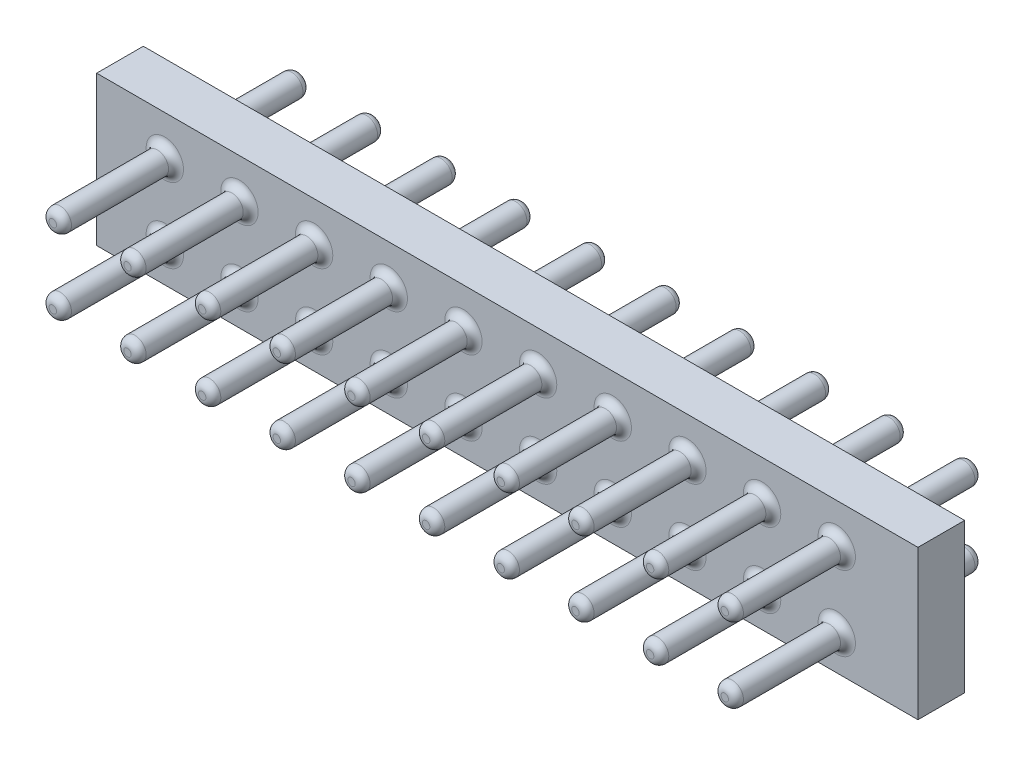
SolidWorks part; units mm, degrees
ref_plane "Front Plane" through (0, 0, 0) normal (0, 0, 1) x (1, 0, 0)
ref_plane "Top Plane" through (0, 0, 0) normal (0, 1, 0) x (1, 0, 0)
ref_plane "Right Plane" through (0, 0, 0) normal (1, 0, 0) x (0, 0, -1)
sketch "Sketch1" plane through (0, 0, 0) normal (0, 0, 1) x (1, 0, 0)
  line L1 (-60.384, -15.7687) -> (-32.444, -15.7687)
  line L2 (-60.384, -15.7687) -> (-60.384, -20.8487)
  line L3 (-60.384, -20.8487) -> (-32.444, -20.8487)
  line L4 (-32.444, -15.7687) -> (-32.444, -20.8487)
  dimension "D1" = 27.94
  dimension "D2" = 5.08
extrude "Extrude1" add sketch "Sketch1" along normal blind 1.5875
sketch "Sketch2" plane through (0, 0, 1.5875) normal (0, 0, 1) x (1, 0, 0)
  circle A0 centre (-58.0653, -17.1247) radius 0.381
  dimension "D1" = 0.762
extrude "Extrude2" add sketch "Sketch2" along normal blind 3.81 and the other way blind 4.572
fillet "Fillet1" radius 0.254 4 edges at (-57.6843, -17.1247, 1.5875) (-57.6843, -17.1247, 5.3975) (-57.6843, -17.1247, 0) (-57.6843, -17.1247, -2.9845)
pattern_linear "LPattern2" count 10 spacing 2.54 along (1, 0, 0) count 2 spacing 2.54 along (0, -1, 0) of "Extrude2"
fillet "Fillet2" radius 0.254 76 edges at (-57.6843, -19.6647, 1.5875) (-57.6843, -19.6647, 5.3975) (-55.1443, -17.1247, 1.5875) (-55.1443, -19.6647, 1.5875) (-55.1443, -19.6647, 5.3975) (-52.6043, -17.1247, 1.5875) (-52.6043, -17.1247, 5.3975) (-52.6043, -19.6647, 1.5875) (-52.6043, -19.6647, 5.3975) (-50.0643, -17.1247, 1.5875) (-50.0643, -17.1247, 5.3975) (-50.0643, -19.6647, 1.5875) (-50.0643, -19.6647, 5.3975) (-47.5243, -17.1247, 1.5875) (-47.5243, -17.1247, 5.3975) (-47.5243, -19.6647, 1.5875) (-47.5243, -19.6647, 5.3975) (-44.9843, -17.1247, 1.5875) (-44.9843, -17.1247, 5.3975) (-44.9843, -19.6647, 1.5875) (-44.9843, -19.6647, 5.3975) (-42.4443, -17.1247, 1.5875) (-42.4443, -17.1247, 5.3975) (-42.4443, -19.6647, 1.5875) (-42.4443, -19.6647, 5.3975) (-39.9043, -17.1247, 1.5875) (-39.9043, -17.1247, 5.3975) (-39.9043, -19.6647, 1.5875) (-39.9043, -19.6647, 5.3975) (-37.3643, -17.1247, 1.5875) (-37.3643, -17.1247, 5.3975) (-37.3643, -19.6647, 1.5875) (-37.3643, -19.6647, 5.3975) (-34.8243, -17.1247, 1.5875) (-34.8243, -17.1247, 5.3975) (-34.8243, -19.6647, 1.5875) (-34.8243, -19.6647, 5.3975) (-55.1443, -17.1247, 5.3975) (-57.6843, -19.6647, 0) (-57.6843, -19.6647, -2.9845) (-55.1443, -17.1247, 0) (-55.1443, -17.1247, -2.9845) (-55.1443, -19.6647, 0) (-55.1443, -19.6647, -2.9845) (-52.6043, -17.1247, 0) (-52.6043, -17.1247, -2.9845) (-52.6043, -19.6647, 0) (-52.6043, -19.6647, -2.9845) (-50.0643, -17.1247, 0) (-50.0643, -17.1247, -2.9845) (-50.0643, -19.6647, 0) (-50.0643, -19.6647, -2.9845) (-47.5243, -17.1247, 0) (-47.5243, -17.1247, -2.9845) (-47.5243, -19.6647, 0) (-47.5243, -19.6647, -2.9845) (-44.9843, -17.1247, 0) (-44.9843, -17.1247, -2.9845) (-44.9843, -19.6647, 0) (-44.9843, -19.6647, -2.9845) (-42.4443, -17.1247, 0) (-42.4443, -17.1247, -2.9845) (-42.4443, -19.6647, 0) (-42.4443, -19.6647, -2.9845) (-39.9043, -17.1247, 0) (-39.9043, -17.1247, -2.9845) (-39.9043, -19.6647, 0) (-39.9043, -19.6647, -2.9845) (-37.3643, -17.1247, 0) (-37.3643, -17.1247, -2.9845) (-37.3643, -19.6647, 0) (-37.3643, -19.6647, -2.9845) (-34.8243, -17.1247, 0) (-34.8243, -17.1247, -2.9845) (-34.8243, -19.6647, 0) (-34.8243, -19.6647, -2.9845)
